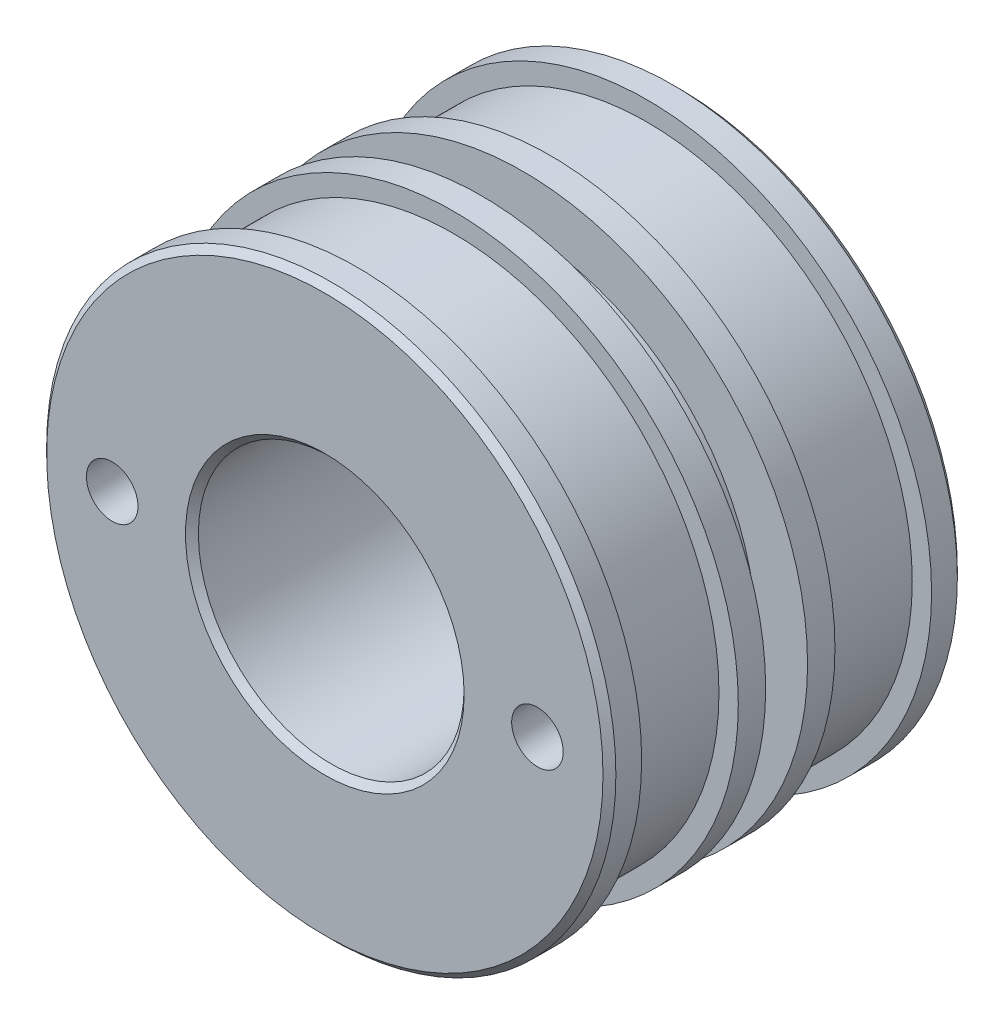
SolidWorks part; units mm, degrees
ref_plane "Front Plane" through (0, 0, 0) normal (0, 0, 1) x (1, 0, 0)
ref_plane "Top Plane" through (0, 0, 0) normal (0, 1, 0) x (1, 0, 0)
ref_plane "Right Plane" through (0, 0, 0) normal (1, 0, 0) x (0, 0, -1)
sketch "Sketch1" plane through (0, 0, 0) normal (0, 0, 1) x (1, 0, 0)
  circle A0 centre (0, 0) radius 44.175
  circle A1 centre (0, 0) radius 20.625
  dimension "D1" = 88.35
  dimension "D2" = 41.25
extrude "Boss-Extrude1" add sketch "Sketch1" against normal blind 55
sketch "Sketch2" plane through (0, 0, 0) normal (1, 0, 0) x (0, 0, -1)
  line L0 (0, 0) -> (63.888, 0) construction
  line L1 (55, 44.175) -> (0, 44.175) construction
  line L2 (5, 44.175) -> (20, 44.175)
  line L3 (5, 44.175) -> (5, 41.175)
  line L4 (5, 41.175) -> (20, 41.175)
  line L5 (20, 44.175) -> (20, 41.175)
  line L6 (0, 44.175) -> (0, -44.175) construction
  line L7 (24.25, 44.175) -> (30.75, 44.175)
  line L8 (24.25, 44.175) -> (24.25, 36.175)
  line L9 (24.25, 36.175) -> (30.75, 36.175)
  line L10 (30.75, 44.175) -> (30.75, 36.175)
  line L11 (35, 44.175) -> (50, 44.175)
  line L12 (35, 44.175) -> (35, 41.175)
  line L13 (35, 41.175) -> (50, 41.175)
  line L14 (50, 44.175) -> (50, 41.175)
  line L15 (55, -44.175) -> (55, 44.175) construction
  dimension "D1" = 5
  dimension "D2" = 3
  dimension "D3" = 15
  dimension "D4" = 6.5
  dimension "D5" = 8
  dimension "D6" = 4.25
  dimension "D7" = 5
revolve "Cut-Revolve1" cut sketch "Sketch2" angle 360 about L0
chamfer "Chamfer1" distance 1 angle 45 4 edges at (44.175, 0, -55) (20.625, 0, -55) (20.625, 0, 0) (44.175, 0, 0)
sketch "Sketch3" plane through (0, 0, -55) normal (0, 0, -1) x (-1, 0, 0)
  circle A0 centre (0, 0) radius 24.5
  dimension "D1" = 49
extrude "Cut-Extrude1" cut sketch "Sketch3" against normal blind 15
chamfer "Chamfer2" distance 1 angle 45 1 edges at (-24.5, 0, -55)
sketch "Sketch4" plane through (0, 0, 0) normal (0, 0, 1) x (1, 0, 0)
  circle A0 centre (0, 0) radius 33 construction
  circle A1 centre (-33, 0) radius 4
  circle A2 centre (33, 0) radius 4
  dimension "D1" = 66
  dimension "D2" = 8
extrude "Cut-Extrude2" cut sketch "Sketch4" against normal blind 9
